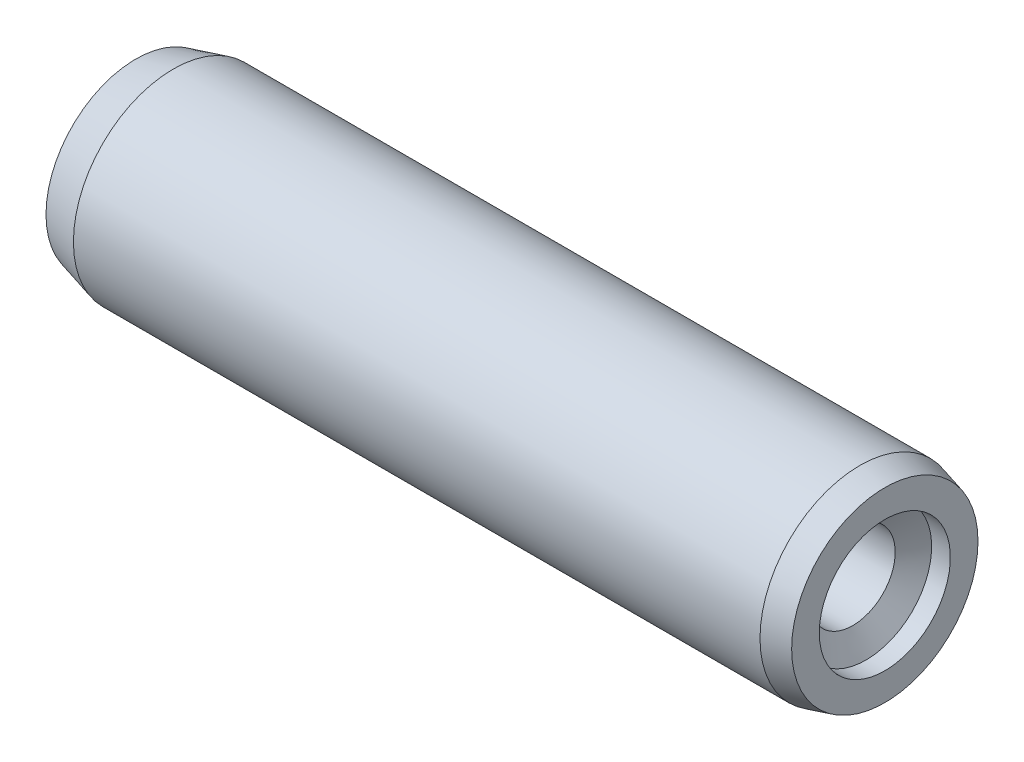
SolidWorks part; units mm, degrees
ref_plane "Plane1" through (0, 0, 0) normal (0, 0, 1) x (1, 0, 0)
ref_plane "Plane2" through (0, 0, 0) normal (0, 1, 0) x (1, 0, 0)
ref_plane "Plane3" through (0, 0, 0) normal (1, 0, 0) x (0, 0, -1)
sketch "BodySke" plane through (0, 0, 0) normal (0, 0, 1) x (1, 0, 0)
  line L0 (0, 0) -> (66, 0) construction
  line L1 (0, 0) -> (40, 0) construction
  line L2 (3, 8) -> (58, 8)
  line L3 (58, 8) -> (60, 7.4641)
  line L4 (0, 0) -> (33.5917, 0)
  line L5 (60, 7.4641) -> (60, 5.25)
  line L6 (60, 5.25) -> (58.5, 5.25)
  line L7 (58.5, 5.25) -> (57.4319, 3.4)
  line L8 (57.4319, 3.4) -> (35, 3.4)
  line L9 (35, 3.4) -> (33.5917, 0)
  line L10 (57.25, 7) -> (57.25, 3) construction
  line L11 (44, 16) -> (44, 0) construction
  line L12 (3, 8) -> (0, 7.1962)
  line L13 (0, 0) -> (0, 7.1962)
  dimension "D3" = 67.5
  dimension "D2" = 165
  dimension "D1" = 75
  dimension "Diameter" = 16
  dimension "Length" = 60
  dimension "Head_ch_len" = 2
  dimension "Cbore_dia" = 10.5
  dimension "Cbore_dep" = 1.5
  dimension "Tapdrill_dia" = 6.8
  dimension "Tapdrill_dep" = 25
  dimension "D4" = 30
  dimension "Advance" = 1.25
  dimension "Thread_dep" = 16
  dimension "Tip_ch_len" = 3
revolve "Body" add sketch "BodySke" angle 360 about L0
sketch "ThdSchSke" plane through (0, 0, 0) normal (0, 0, 1) x (1, 0, 0)
  line L0 (57.7783, 4) -> (58.2618, 3.3095)
  line L2 (57.7783, 4) -> (57.2948, 3.3095)
  line L3 (57.2948, 3.3095) -> (58.2618, 3.3095)
  line L4 (57.7783, 5.8566) -> (57.7783, 1.7596) construction
  line L5 (27, 0) -> (36, 0) construction
  line L6 (0, 0) -> (66, 0) construction
  line L7 (60, -7.4641) -> (60, 7.4641) construction
  dimension "D1" = 70
  dimension "Thread_nominal" = 8
  dimension "Inset" = 2.2217
  dimension "Thread_minor" = 6.619
revolve "ThreadSchematic" [suppressed] cut sketch "ThdSchSke" angle 360 about L5
pattern_linear "ThdSchPat" [suppressed]
equation "' \"Diameter@BodySke\" = 16"
equation "' \"Head_ch_len@BodySke\" = 2"
equation "' \"Tip_ch_len@BodySke\" = 3"
equation "' \"Thread_major@ThreadCosmetic\"  = 8"
equation "' \"Advance@BodySke\" = 1.25"
equation "' \"Cbore_dia@BodySke\" = 10.5"
equation "' \"Thread_dep@BodySke\"  = 16"
equation "' \"Tapdrill_dep@BodySke\" = 25"
equation "' \"Cbore_dep@BodySke\" = 1.5"
equation "' \"Tapdrill_dia@BodySke\" = 6.8"
equation "' \"Thread_minor@ThdSchSke\" = 6.619"
equation "'  \"Length@BodySke\" = 60"
equation "' \"Diameter@BodySke\" = 30"
equation "' \"Head_ch_len@BodySke\" = 4"
equation "' \"Tip_ch_len@BodySke\" = 5"
equation "' \"Thread_major@ThreadCosmetic\"  = 20"
equation "' \"Advance@BodySke\" = 2.5"
equation "' \"Cbore_dia@BodySke\" = 21"
equation "' \"Thread_dep@BodySke\"  = 30"
equation "' \"Tapdrill_dep@BodySke\" = 40"
equation "' \"Cbore_dep@BodySke\" = 2"
equation "' \"Tapdrill_dia@BodySke\" = 17.5"
equation "' \"Thread_minor@ThdSchSke\" = 17.252"
equation "\"Depth@ThreadCosmetic\" = \"Thread_dep@BodySke\"  -  \"Cbore_dep@BodySke\""
equation "\"Thread_nominal@ThdSchSke\" = \"Thread_major@ThreadCosmetic\""
equation "\"Inset@ThdSchSke\" = \"Cbore_dep@BodySke\" + (\"Cbore_dia@BodySke\" - \"Thread_major@ThreadCosmetic\") / 2 * tan(30 * 0.0174533)"
equation "\"Num_threads@ThdSchPat\" = int(  ( \"Thread_dep@BodySke\"  - \"Inset@ThdSchSke\" ) / \"Advance@BodySke\" + 0.999 )  + 1"
equation "\"Advance@ThdSchPat\" = (  \"Thread_dep@BodySke\" - \"Inset@ThdSchSke\" ) /  (\"Num_threads@ThdSchPat\" - 1) 'relax it"
